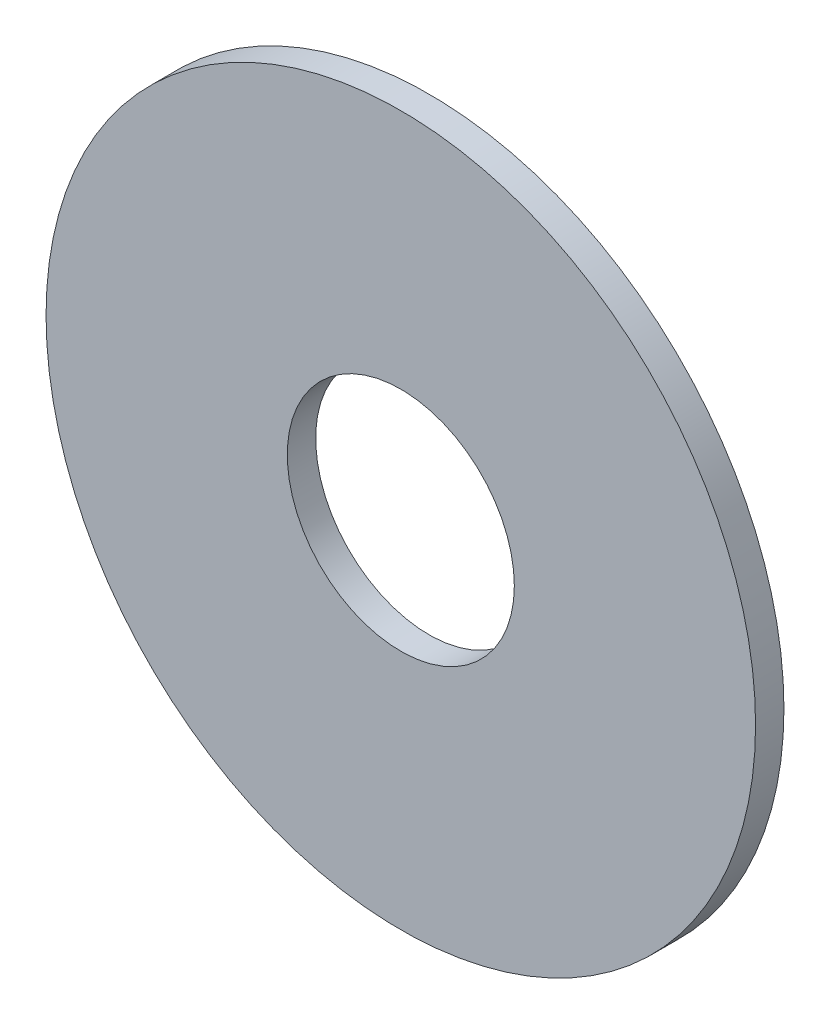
SolidWorks part; units mm, degrees
ref_plane "Front Plane" through (0, 0, 0) normal (0, 0, 1) x (1, 0, 0)
ref_plane "Top Plane" through (0, 0, 0) normal (0, 1, 0) x (1, 0, 0)
ref_plane "Right Plane" through (0, 0, 0) normal (1, 0, 0) x (0, 0, -1)
sketch "Sketch1" plane through (0, 0, 0) normal (0, 0, 1) x (1, 0, 0)
  circle A0 centre (0, 0) radius 12.5
extrude "Boss-Extrude1" add sketch "Sketch1" against normal blind 1
sketch "Sketch2" plane through (0, 0, 0) normal (0, 0, 1) x (1, 0, 0)
  circle A0 centre (0, 0) radius 4
extrude "Cut-Extrude1" cut sketch "Sketch2" against normal blind 1
